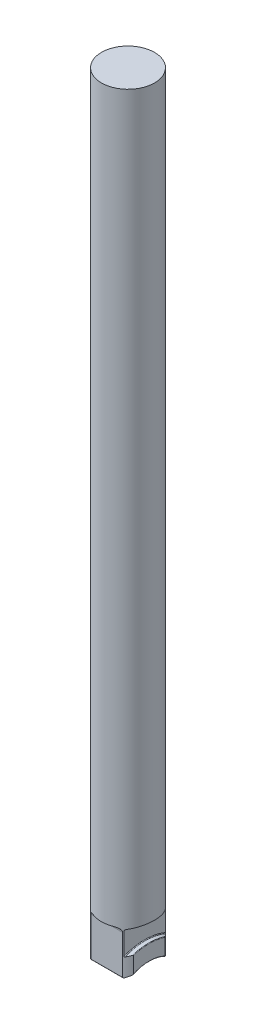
SolidWorks part; units mm, degrees
ref_plane "Front Plane" through (0, 0, 0) normal (0, 0, 1) x (1, 0, 0)
ref_plane "Top Plane" through (0, 0, 0) normal (0, 1, 0) x (1, 0, 0)
ref_plane "Right Plane" through (0, 0, 0) normal (1, 0, 0) x (0, 0, -1)
sketch "Sketch1" plane through (0, 0, 0) normal (1, 0, 0) x (0, 0, -1)
  line L0 (-15.875, 479.425) -> (-15.875, 0)
  line L1 (0, 249.2329) -> (0, 0) construction
  line L2 (15.875, 479.425) -> (15.875, 0)
  line L3 (-15.875, 479.425) -> (15.875, 479.425)
  line L6 (-15.875, 0) -> (15.875, 0)
  arc A0 (-22.225, 0) -> (22.225, 0) centre (0, 0) cw construction
  dimension "R" = 22.225
  dimension "L" = 457.2
  dimension "T" = 31.75
extrude "Boss-Extrude1" add sketch "Sketch1" along normal mid plane 31.75
sketch "Sketch8" plane through (0, 0, 0) normal (1, 0, 0) x (0, 0, -1)
  circle A0 centre (0, 0) radius 22.225
  arc A1 (22.225, 0) -> (-22.225, 0) centre (0, 0) ccw construction
extrude "Cut-Extrude4" cut sketch "Sketch8" against normal through all both and the other way through all
sketch "Sketch2" plane through (0, 0, 0) normal (0, 0, 1) x (1, 0, 0)
  line L0 (15.875, 31.75) -> (9.906, 31.75)
  line L1 (15.875, 479.425) -> (15.875, 15.5543) construction
  line L2 (9.906, 31.75) -> (9.906, 45.212)
  line L3 (9.906, 45.212) -> (15.875, 45.212)
  line L4 (15.875, 45.212) -> (15.875, 31.75)
  line L5 (0, 29.9173) -> (0, 0) construction
  line L6 (-15.875, 45.212) -> (-15.875, 31.75)
  line L7 (-9.906, 45.212) -> (-15.875, 45.212)
  line L8 (-9.906, 31.75) -> (-9.906, 45.212)
  line L9 (-15.875, 31.75) -> (-9.906, 31.75)
  line L10 (-8.8482, 0) -> (24.5305, 0) construction
  dimension "D1" = 19.812
  dimension "D2" = 45.212
  dimension "D3" = 31.75
revolve "Cut-Revolve1" cut sketch "Sketch2" angle 360 about L10
sketch "Sketch6" plane through (0, 0, 0) normal (1, 0, 0) x (0, 0, -1)
  line L0 (0, 19.903) -> (0, 0) construction
  line L1 (12.7, 0) -> (31.75, 0)
  line L2 (12.7, 0) -> (12.7, 42.037)
  line L3 (15.0876, 44.4246) -> (31.75, 44.4246)
  line L4 (31.75, 0) -> (31.75, 44.4246)
  line L9 (-12.7, 0) -> (-31.75, 0)
  line L10 (-31.75, 0) -> (-31.75, 44.4246)
  line L11 (-15.0876, 44.4246) -> (-31.75, 44.4246)
  line L12 (-12.7, 0) -> (-12.7, 42.037)
  arc A0 (12.7, 42.037) -> (15.0876, 44.4246) centre (15.0876, 42.037) cw
  arc A1 (-12.7, 42.037) -> (-15.0876, 44.4246) centre (-15.0876, 42.037) ccw
  arc A4 (15.875, 15.5543) -> (-15.875, 15.5543) centre (0, 0) ccw construction
  dimension "D3" = 2.3876
  dimension "MT" = 25.4
  dimension "D2" = 19.05
  dimension "D4" = 19.812
extrude "Cut-Extrude2" cut sketch "Sketch6" against normal through all both and the other way through all
sketch "Sketch7" plane through (0, 0, 0) normal (0, 0, 1) x (1, 0, 0)
  line L6 (-15.875, 31.75) -> (-12.7, 31.75)
  line L8 (-15.875, 31.75) -> (-15.875, 0)
  line L9 (-15.875, 0) -> (-12.7, 0)
  line L10 (-12.7, 31.75) -> (-12.7, 0)
  line L11 (0, 16.5651) -> (0, 5.9342) construction
  line L12 (12.7, 31.75) -> (12.7, 0)
  line L13 (15.875, 0) -> (12.7, 0)
  line L14 (15.875, 31.75) -> (15.875, 0)
  line L15 (15.875, 31.75) -> (12.7, 31.75)
  dimension "MW" = 25.4
extrude "Cut-Extrude3" cut sketch "Sketch7" against normal through all both and the other way through all
fillet "Fillet1" radius 0.762 2 edges at (-9.906, 45.212, 0) (9.906, 45.212, 0)
fillet "Fillet2" radius 0.381 2 edges at (-9.906, 31.75, 0) (9.906, 31.75, 0)
fillet "Fillet3" radius 0.254 10 edges at (12.7, 23.6692, -12.7) (12.7, 23.6692, 12.7) (12.7, 31.75, 0) (-12.7, 23.6692, 12.7) (-12.7, 23.6692, -12.7) (-12.7, 31.75, 0) (12.7, 22.225, 0) (-12.7, 22.225, 0) (0, 18.239, -12.7) (0, 18.239, 12.7)
sketch "Sketch9" plane through (0, 479.425, 0) normal (0, 1, 0) x (1, 0, 0)
  circle A0 centre (0, 0) radius 15.875
  dimension "D1" = 31.75
extrude "Cut-Extrude5" cut sketch "Sketch9" against normal through all flip side to cut
